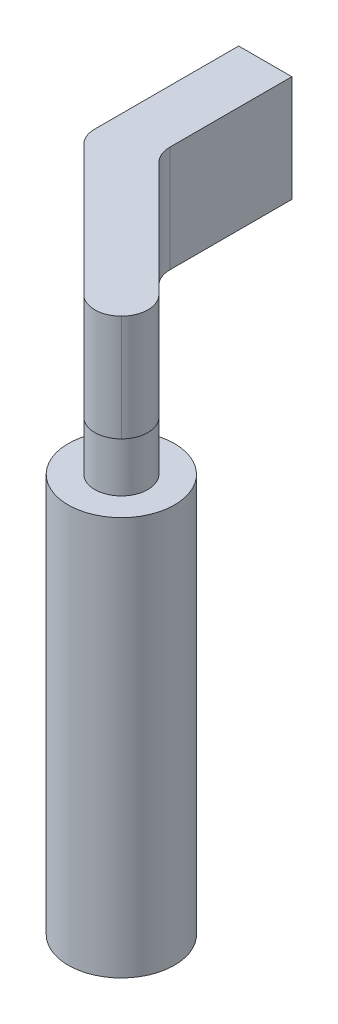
SolidWorks part; units mm, degrees
ref_plane "Ön Düzlem" through (0, 0, 0) normal (0, 0, 1) x (1, 0, 0)
ref_plane "Üst Düzlem" through (0, 0, 0) normal (0, 1, 0) x (1, 0, 0)
ref_plane "Sağ Düzlem" through (0, 0, 0) normal (1, 0, 0) x (0, 0, -1)
sketch "Sketch1" plane through (0, 0, 0) normal (0, 1, 0) x (1, 0, 0)
  line L0 (0, 0) -> (20, 0)
  line L1 (20, 0) -> (20, -50)
  line L2 (20, -50) -> (73.033, -103.033)
  line L3 (73.033, -103.033) -> (58.8909, -117.1751)
  line L4 (58.8909, -117.1751) -> (0, -58.2843)
  line L5 (0, -58.2843) -> (0, 0)
  dimension "D1" = 20
  dimension "D2" = 20
  dimension "D3" = 50
  dimension "D4" = 75
extrude "Boss-Extrude1" add sketch "Sketch1" along normal blind 40
sketch "Sketch2" plane through (0, 0, 0) normal (0, -1, 0) x (1, 0, 0)
  line L0 (58.8909, 117.1751) -> (73.033, 103.033) construction
  circle A0 centre (57.4767, 101.6188) radius 10
  dimension "D1" = 12
extrude "Boss-Extrude2" add sketch "Sketch2" along normal blind 20
sketch "Sketch3" plane through (0, -20, 0) normal (0, -1, 0) x (1, 0, 0)
  circle A0 centre (57.4767, 101.6188) radius 20
  dimension "D1" = 40
extrude "Boss-Extrude3" add sketch "Sketch3" along normal blind 150
fillet "Fillet1" radius 10 2 edges at (20, 20, 50) (0, 20, 58.2843)
fillet "Fillet2" radius 10 2 edges at (73.033, 20, 103.033) (58.8909, 20, 117.1751)
